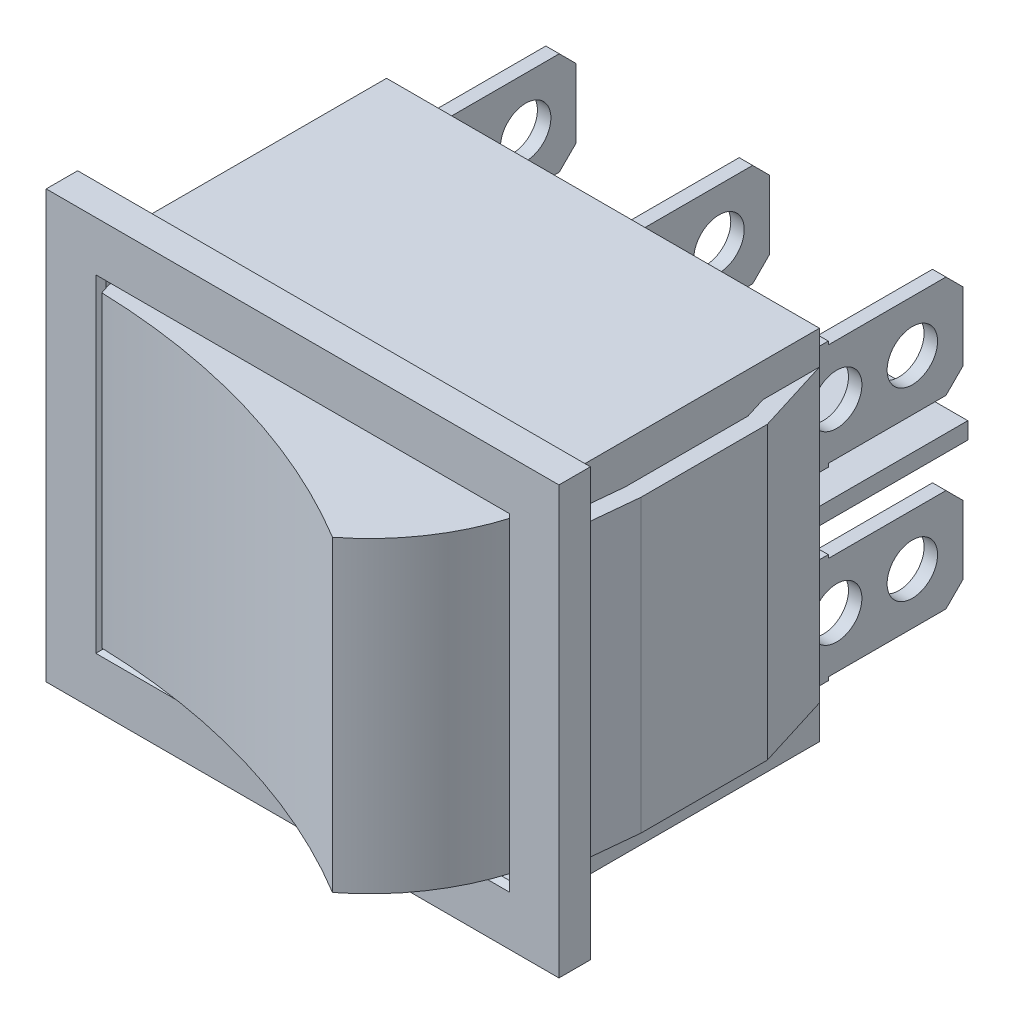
SolidWorks part; units mm, degrees
ref_plane "Front Plane" through (0, 0, 0) normal (0, 0, 1) x (1, 0, 0)
ref_plane "Top Plane" through (0, 0, 0) normal (0, 1, 0) x (1, 0, 0)
ref_plane "Right Plane" through (0, 0, 0) normal (1, 0, 0) x (0, 0, -1)
sketch "Sketch1" plane through (0, 0, 0) normal (0, 0, 1) x (1, 0, 0)
  line L1 (-12.875, 10.65) -> (12.875, 10.65)
  line L2 (-12.875, 10.65) -> (-12.875, -10.65)
  line L3 (-12.875, -10.65) -> (12.875, -10.65)
  line L4 (12.875, 10.65) -> (12.875, -10.65)
  line L5 (-12.875, 10.65) -> (12.875, -10.65) construction
  line L6 (-12.875, -10.65) -> (12.875, 10.65) construction
  point P0 (0, 0)
  dimension "D1" = 21.3
  dimension "D2" = 25.75
extrude "Boss-Extrude1" add sketch "Sketch1" along normal blind 16
sketch "Sketch3" plane through (0, 0, 16) normal (0, 0, 1) x (1, 0, 0)
  line L1 (-15.25, 12.7) -> (15.25, 12.7)
  line L2 (-15.25, 12.7) -> (-15.25, -12.7)
  line L3 (-15.25, -12.7) -> (15.25, -12.7)
  line L4 (15.25, 12.7) -> (15.25, -12.7)
  line L5 (-15.25, 12.7) -> (15.25, -12.7) construction
  line L6 (-15.25, -12.7) -> (15.25, 12.7) construction
  point P0 (0, 0)
  dimension "D1" = 25.4
  dimension "D2" = 30.5
extrude "Boss-Extrude3" add sketch "Sketch3" along normal blind 1.87
sketch "Sketch4" plane through (0, 0, 0) normal (0, 0, -1) x (-1, 0, 0)
  line L1 (-11.9, 0.5) -> (11.9, 0.5)
  line L2 (-11.9, 0.5) -> (-11.9, -0.5)
  line L3 (-11.9, -0.5) -> (11.9, -0.5)
  line L4 (11.9, 0.5) -> (11.9, -0.5)
  line L5 (-11.9, 0.5) -> (11.9, -0.5) construction
  line L6 (-11.9, -0.5) -> (11.9, 0.5) construction
  point P0 (0, 0)
  dimension "D1" = 1
  dimension "D2" = 23.8
extrude "Boss-Extrude4" add sketch "Sketch4" along normal blind 9.8
sketch "Sketch5" plane through (0, 0, 0) normal (0, 0, -1) x (-1, 0, 0)
  line L0 (-11.9, -0.5) -> (11.9, -0.5) construction
  line L1 (11.1, -2.25) -> (11.9, -2.25)
  line L2 (11.1, -2.25) -> (11.1, -8.75)
  line L3 (11.1, -8.75) -> (11.9, -8.75)
  line L4 (11.9, -2.25) -> (11.9, -8.75)
  line L5 (11.1, -2.25) -> (11.9, -8.75) construction
  line L6 (11.1, -8.75) -> (11.9, -2.25) construction
  line L7 (-0.4, -8.75) -> (0.4, -8.75)
  line L8 (-0.4, -8.75) -> (-0.4, -2.25)
  line L9 (-0.4, -2.25) -> (0.4, -2.25)
  line L10 (0.4, -8.75) -> (0.4, -2.25)
  line L11 (-0.4, -8.75) -> (0.4, -2.25) construction
  line L12 (-0.4, -2.25) -> (0.4, -8.75) construction
  line L13 (-11.9, -2.25) -> (-11.1, -2.25)
  line L14 (-11.9, -2.25) -> (-11.9, -8.75)
  line L15 (-11.9, -8.75) -> (-11.1, -8.75)
  line L16 (-11.1, -2.25) -> (-11.1, -8.75)
  line L17 (-11.9, -2.25) -> (-11.1, -8.75) construction
  line L18 (-11.9, -8.75) -> (-11.1, -2.25) construction
  point P0 (11.5, -5.5)
  point P5 (-11.5, -5.5)
  point P6 (0, -5.5)
  dimension "D1" = 6.5
  dimension "D2" = 0.8
  dimension "D3" = 6.5
  dimension "D4" = 0.8
  dimension "D5" = 6.5
  dimension "D6" = 0.8
  dimension "D7" = 5
extrude "Boss-Extrude5" add sketch "Sketch5" along normal blind 9.5
sketch "Sketch6" plane through (11.9, 0, 0) normal (1, 0, 0) x (0, 0, -1)
  line L1 (9.5, -2.25) -> (1.5, -2.25)
  line L2 (9.5, -2.25) -> (9.5, -2.45)
  line L3 (9.5, -2.45) -> (1.5, -2.45)
  line L4 (1.5, -2.25) -> (1.5, -2.45)
  line L5 (9.5, -8.75) -> (1.5, -8.75)
  line L6 (9.5, -8.75) -> (9.5, -8.55)
  line L7 (9.5, -8.55) -> (1.5, -8.55)
  line L8 (1.5, -8.75) -> (1.5, -8.55)
  dimension "D1" = 0.2
  dimension "D2" = 8
extrude "Cut-Extrude1" cut sketch "Sketch6" against normal through all
chamfer "Chamfer1" distance 1 angle 45 6 edges at (-11.5, -8.55, -9.5) (-11.5, -2.45, -9.5) (0, -8.55, -9.5) (0, -2.45, -9.5) (11.5, -2.45, -9.5) (11.5, -8.55, -9.5)
sketch "Sketch7" plane through (11.9, 0, 0) normal (1, 0, 0) x (0, 0, -1)
  line L0 (1.5, -2.25) -> (0, -2.25) construction
  line L1 (9.5, -3.45) -> (9.5, -7.55) construction
  circle A0 centre (6.5, -5.5) radius 1.5
  circle A1 centre (2, -5.5) radius 1.5
  dimension "D1" = 3.25
  dimension "D2" = 3
  dimension "D3" = 3
  dimension "D4" = 4.5
extrude "Cut-Extrude2" cut sketch "Sketch7" against normal through all
ref_plane "Plane1" through (0, 0, 0) normal (0, -1, 0) x (-1, 0, 0)
mirror "Mirror1" about plane through (0, 0, 0) normal (0, -1, 0) of "Cut-Extrude2", "Chamfer1", "Cut-Extrude1", "Boss-Extrude5"
sketch "Sketch8" plane through (0, 10.65, 0) normal (0, 1, 0) x (1, 0, 0)
  line L0 (-12.875, 0) -> (-14.275, -4.5)
  line L1 (-12.875, -16) -> (-12.875, 0) construction
  line L2 (-14.275, -4.5) -> (-14.275, -12)
  line L3 (-14.275, -12) -> (-13.8799, -16)
  line L4 (15.25, -16) -> (-15.25, -16) construction
  line L5 (-13.8799, -16) -> (-12.875, -16)
  line L6 (-12.875, -16) -> (-13.275, -11.9507)
  line L7 (-13.275, -11.9507) -> (-13.275, -4.652)
  line L8 (-13.275, -4.652) -> (-12.875, -3.3662)
  line L9 (-12.875, -3.3662) -> (-12.875, 0)
  line L10 (12.875, 0) -> (-12.875, 0) construction
  line L11 (12.875, -16) -> (-12.875, -16) construction
  dimension "D1" = 1
  dimension "D2" = 1
  dimension "D3" = 1
  dimension "D4" = 1.4
  dimension "D5" = 4.5
  dimension "D6" = 4
extrude "Boss-Extrude6" add sketch "Sketch8" against normal offset from surface (17.3 mm away) 2 from offset 2
ref_plane "Plane2" through (0, 0, 0) normal (-1, 0, 0) x (0, 0, 1)
mirror "Mirror2" about plane through (0, 0, 0) normal (-1, 0, 0) of "Boss-Extrude6"
sketch "Sketch9" plane through (0, 0, 17.87) normal (0, 0, 1) x (1, 0, 0)
  line L0 (-12, -9.45) -> (-12, 9.45)
  line L1 (-15.25, -12.7) -> (15.25, -12.7)
  line L2 (-15.25, -12.7) -> (-15.25, 12.7)
  line L3 (-15.25, 12.7) -> (15.25, 12.7)
  line L4 (15.25, -12.7) -> (15.25, 12.7)
  line L5 (-12, 9.45) -> (12, 9.45)
  line L6 (12, -9.45) -> (12, 9.45)
  line L7 (-12, -9.45) -> (12, -9.45)
  dimension "D1" = 3.25
extrude "Cut-Extrude3" cut sketch "Sketch9" against normal blind 5 contours L0 L7 L6 L5
sketch "Sketch10" plane through (0, 0, 0) normal (0, -1, 0) x (-1, 0, 0)
  line L0 (15.25, -17.87) -> (-15.25, -17.87) construction
  circle A0 centre (0, -13.87) radius 12.5
  dimension "D1" = 4
  dimension "D2" = 25
extrude "Boss-Extrude7" add sketch "Sketch10" along normal mid plane 18.3
sketch "Sketch11" plane through (0, 0, 0) normal (0, -1, 0) x (-1, 0, 0)
  circle A0 centre (13, -58) radius 40
  dimension "D1" = 80
  dimension "D2" = 58
  dimension "D3" = 13
extrude "Cut-Extrude4" cut sketch "Sketch11" against normal through all both and the other way through all
chamfer "Chamfer2" distance 0.3 angle 45 4 edges at (0, -9.45, 17.87) (12, 0, 17.87) (0, 9.45, 17.87) (-12, 0, 17.87)
sketch "Sketch12" plane through (0, 0, 0) normal (0, 0, 1) x (1, 0, 0)
  line L1 (15, -10.85) -> (-15, -10.85)
  line L2 (15, -10.85) -> (15, 10.85)
  line L3 (15, 10.85) -> (-15, 10.85)
  line L4 (-15, -10.85) -> (-15, 10.85)
  line L5 (15, -10.85) -> (-15, 10.85) construction
  line L6 (15, 10.85) -> (-15, -10.85) construction
  point P0 (0, 0)
  dimension "D1" = 30
  dimension "D2" = 21.7
